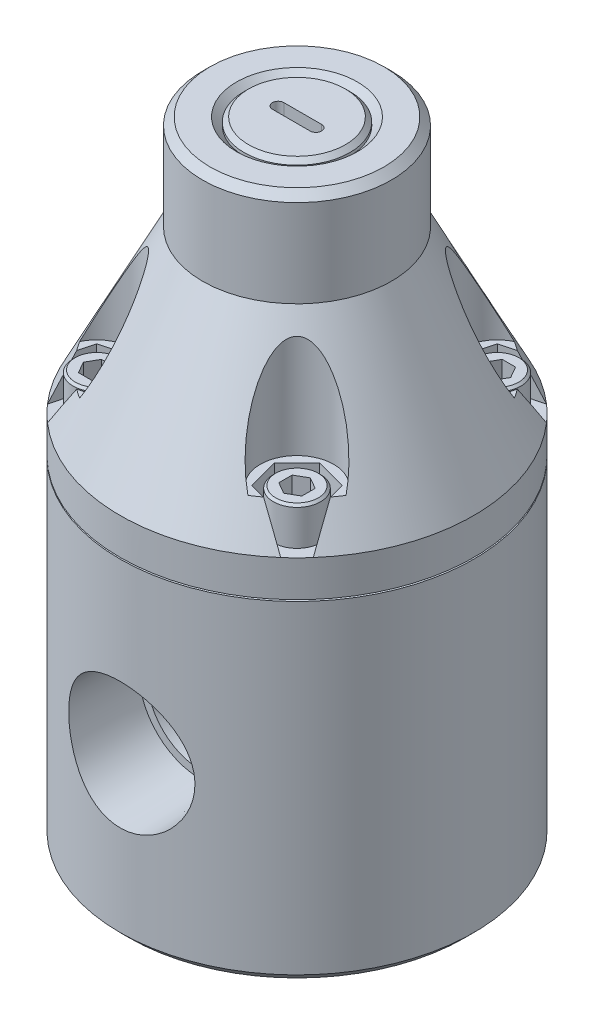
SolidWorks part; units mm, degrees
ref_plane "Front Plane" through (0, 0, 0) normal (0, 0, 1) x (1, 0, 0)
ref_plane "Top Plane" through (0, 0, 0) normal (0, 1, 0) x (1, 0, 0)
ref_plane "Right Plane" through (0, 0, 0) normal (1, 0, 0) x (0, 0, -1)
sketch "Sketch1" plane through (0, 0, 0) normal (0, 1, 0) x (1, 0, 0)
  circle A0 centre (0, 0) radius 29.718
  dimension "D1" = 59.436
extrude "Extrude1" add sketch "Sketch1" along normal blind 105.41
sketch "Sketch2" plane through (0, 0, 0) normal (0, 0, 1) x (1, 0, 0)
  line L0 (0, 0) -> (0, 105.41) construction
  line L1 (29.718, 105.41) -> (-29.718, 105.41) construction
  line L2 (-29.718, 55.88) -> (-20.6255, 55.88)
  line L3 (-29.718, 105.41) -> (-29.718, 0) construction
  line L4 (-20.6255, 55.88) -> (-20.6255, 56.134)
  line L5 (-20.6255, 56.134) -> (-29.718, 56.134)
  line L6 (-29.718, 56.134) -> (-29.718, 62.23)
  line L7 (-29.718, 62.23) -> (-15.875, 89.408)
  line L8 (-15.875, 89.408) -> (-15.875, 105.41)
  line L9 (-15.875, 105.41) -> (-21.1252, 108.0842)
  line L10 (-21.1252, 108.0842) -> (-34.3087, 108.0842)
  line L11 (-34.3087, 108.0842) -> (-34.3087, 59.0996)
  line L12 (-34.3087, 59.0996) -> (-29.718, 55.88)
  line L13 (-29.718, 0) -> (29.718, 0) construction
  dimension "D1" = 55.88
  dimension "D2" = 0.254
  dimension "D3" = 29.718
  dimension "D4" = 6.35
  dimension "D5" = 27.178
  dimension "D6" = 15.875
revolve "Cut-Revolve1" cut sketch "Sketch2" angle 360 about L0
ref_plane "Plane1" through (0, 105.41, 0) normal (0, 1, 0) x (-1, 0, 0)
sketch "Sketch3" plane through (0, 105.41, 0) normal (0, 1, 0) x (-1, 0, 0)
  circle A0 centre (0, 0) radius 10.16
  dimension "D1" = 20.32
extrude "Extrude2" cut sketch "Sketch3" against normal blind 1.27 draft 45
ref_plane "Plane2" through (0, 0, 29.718) normal (0, 0, 1) x (1, 0, 0)
sketch "Sketch4" plane through (0, 0, 29.718) normal (0, 0, 1) x (1, 0, 0)
  line L0 (0, 0) -> (0, 55.88) construction
  line L1 (29.718, 55.88) -> (-29.718, 55.88) construction
  line L2 (29.718, 27.432) -> (-29.718, 27.432) construction
  line L6 (29.718, 0) -> (29.718, 55.88) construction
  line L7 (-29.718, 55.88) -> (-29.718, 0) construction
  line L8 (-29.718, 0) -> (29.718, 0) construction
  dimension "D1" = 27.432
hole_wizard "1/2 NPT Tapped Hole1" positions "3DSketch1" profile "Sketch5" size "1/2" standard "Ansi Inch"
sketch3d "3DSketch1"
  line L0 (29.718, 27.432, 29.718) -> (-29.718, 27.432, 29.718) construction
  point P0 (0, 27.432, 29.718)
  point P5 (0, 27.432, 29.718)
sketch "Sketch5" plane through (0, 27.432, 29.718) normal (1, 0, 0) x (0, -1, 0)
  line L0 (0, 0) -> (0, 20.2081)
  line L1 (8.9281, 16.51) -> (0, 20.2081)
  line L2 (-8.9281, 16.51) -> (0, 20.2081) construction
  line L3 (8.9281, 16.51) -> (8.9281, 13.462)
  line L4 (8.9281, 13.462) -> (10.2617, 13.462)
  line L5 (10.2617, 13.462) -> (10.6647, 0)
  line L6 (-10.2617, 13.462) -> (-10.6647, 0) construction
  line L7 (10.6647, 0) -> (0, 0)
  line L8 (0, -6.35) -> (0, 107.95) construction
  line L11 (-8.9281, 13.462) -> (-10.2617, 13.462) construction
  dimension "Tap Drill Dia." = 17.8562
  dimension "Tap Drill Depth" = 16.51
  dimension "Thread Dia." = 21.3295
  dimension "Thread Angle" = 3.43
  dimension "Thread Depth" = 13.462
  dimension "Drill Angle" = 135
pattern_circular "CirPattern1" count 2 over 360 about axis through (0, 105.41, 0) along (0, -1, 0) of "1/2 NPT Tapped Hole1"
chamfer "Chamfer1" distance 1.27 angle 45 1 edges at (0, 105.41, -15.875)
chamfer "Chamfer2" distance 1.524 angle 45 1 edges at (0, 0, 29.718)
sketch "Sketch6" plane through (0, 105.41, 0) normal (0, 1, 0) x (-1, 0, 0)
  circle A0 centre (0, 0) radius 8.89
extrude "Extrude3" add sketch "Sketch6" against normal up to surface (1.27 mm away)
chamfer "Chamfer3" distance 0.762 angle 45 1 edges at (0, 105.41, 8.89)
sketch "Sketch7" plane through (0, 105.41, 0) normal (0, 1, 0) x (-1, 0, 0)
  line L0 (0, 0) -> (-3.175, 0) construction
  line L1 (-3.175, 0.9652) -> (3.175, 0.9652)
  line L2 (3.175, -0.9652) -> (-3.175, -0.9652)
  arc A0 (-3.175, 0.9652) -> (-3.175, -0.9652) centre (-3.175, 0) ccw
  arc A1 (3.175, -0.9652) -> (3.175, 0.9652) centre (3.175, 0) ccw
  dimension "D1" = 3.175
  dimension "D2" = 6.35
  dimension "D3" = 0.9652
  dimension "D4" = 0.9652
extrude "Extrude4" cut sketch "Sketch7" against normal blind 4.7498
ref_plane "Plane3" through (0, 68.58, 0) normal (0, 1, 0) x (-1, 0, 0)
sketch "Sketch8" plane through (0, 68.58, 0) normal (0, 1, 0) x (-1, 0, 0)
  line L0 (0, 0) -> (0, -29.718) construction
  line L1 (0, 0) -> (-21.0138, -21.0138) construction
  circle A1 centre (0, 0) radius 29.718 construction
  circle A2 centre (0, 0) radius 23.8125 construction
  circle A3 centre (-16.838, -16.838) radius 6.1722
  dimension "D2" = 47.625
  dimension "D3" = 12.3444
  dimension "D1" = 45
extrude "Extrude5" cut sketch "Sketch8" along normal blind 21.0058
pattern_circular "CirPattern2" count 4 over 360 about axis through (0, 0, 0) along (0, 1, 0) of "Extrude5"
sketch "Sketch9" plane through (0, 68.58, 0) normal (0, 1, 0) x (-1, 0, 0)
  line L0 (0, 0) -> (0, -29.718) construction
  line L1 (0, 0) -> (-21.0138, -21.0138) construction
  line L2 (-16.838, -16.838) -> (-21.0138, -12.6622) construction
  line L5 (-20.6332, -13.0427) -> (-23.298, -23.298)
  line L7 (-13.0427, -20.6332) -> (-11.6536, -15.4488)
  line L8 (-11.6536, -15.4488) -> (-15.4488, -11.6536)
  line L9 (-15.4488, -11.6536) -> (-20.6332, -13.0427)
  line L10 (-22.0224, -18.2271) -> (-18.2271, -22.0224)
  line L11 (-23.298, -23.298) -> (-13.0427, -20.6332)
  line L13 (-20.6332, -13.0427) -> (-22.0224, -18.2271)
  line L14 (-18.2271, -22.0224) -> (-13.0427, -20.6332)
  circle A0 centre (0, 0) radius 29.718 construction
  circle A1 centre (0, 0) radius 23.8125 construction
  circle A2 centre (-16.838, -16.838) radius 4.6482 construction
  circle A3 centre (-16.838, -16.838) radius 4.6482 construction
  dimension "D1" = 9.2964
extrude "Extrude6" cut sketch "Sketch9" against normal blind 6.35
pattern_circular "CirPattern3" count 4 over 360 about axis through (0, 0, 0) along (0, 1, 0) of "Extrude6"
sketch "Sketch10" plane through (0, 68.58, 0) normal (0, 1, 0) x (-1, 0, 0)
  circle A0 centre (-16.838, -16.838) radius 3.9624
  dimension "D1" = 7.9248
extrude "Extrude7" add sketch "Sketch10" against normal up to surface (6.35 mm away)
sketch "Sketch11" plane through (0, 68.58, 0) normal (0, 1, 0) x (-1, 0, 0)
  line L1 (-19.0755, -16.838) -> (-17.9568, -18.7758)
  line L2 (-17.9568, -18.7758) -> (-15.7192, -18.7758)
  line L3 (-15.7192, -18.7758) -> (-14.6004, -16.838)
  line L4 (-14.6004, -16.838) -> (-15.7192, -14.9002)
  line L5 (-15.7192, -14.9002) -> (-17.9568, -14.9002)
  line L6 (-17.9568, -14.9002) -> (-19.0755, -16.838)
  circle A0 centre (-16.838, -16.838) radius 1.9378 construction
extrude "Extrude8" cut sketch "Sketch11" against normal blind 3.175
pattern_circular "CirPattern4" count 4 over 360 about axis through (0, 0, 0) along (0, 1, 0) of "Extrude7", "Extrude8"
chamfer "Chamfer5" distance 0.381 angle 45 4 edges at (16.838, 68.58, -12.8756) (12.8756, 68.58, 16.838) (-16.838, 68.58, 12.8756) (-12.8756, 68.58, -16.838)
hole_wizard "1/2 NPT Tapped Hole2" positions "3DSketch2" profile "Sketch13" size "1/2" standard "Ansi Inch"
sketch3d "3DSketch2"
  circle A0 centre (0, 1.524, 0) radius 29.718 construction
  point P0 (0, 0, 0)
  point P4 (0, 1.524, 0)
  point P8 (0, 31.242, 0)
  point P10 (0, 0, 0)
sketch "Sketch13" plane through (0, 0, 0) normal (1, 0, 0) x (0, 0, -1)
  line L0 (0, 0) -> (0, 20.2081)
  line L1 (8.9281, 16.51) -> (0, 20.2081)
  line L2 (-8.9281, 16.51) -> (0, 20.2081) construction
  line L3 (8.9281, 16.51) -> (8.9281, 13.462)
  line L4 (8.9281, 13.462) -> (10.2617, 13.462)
  line L5 (10.2617, 13.462) -> (10.6647, 0)
  line L6 (-10.2617, 13.462) -> (-10.6647, 0) construction
  line L7 (10.6647, 0) -> (0, 0)
  line L8 (0, -6.35) -> (0, 107.95) construction
  line L11 (-8.9281, 13.462) -> (-10.2617, 13.462) construction
  dimension "Tap Drill Dia." = 17.8562
  dimension "Tap Drill Depth" = 16.51
  dimension "Thread Dia." = 21.3295
  dimension "Thread Angle" = 3.43
  dimension "Thread Depth" = 13.462
  dimension "Drill Angle" = 135
